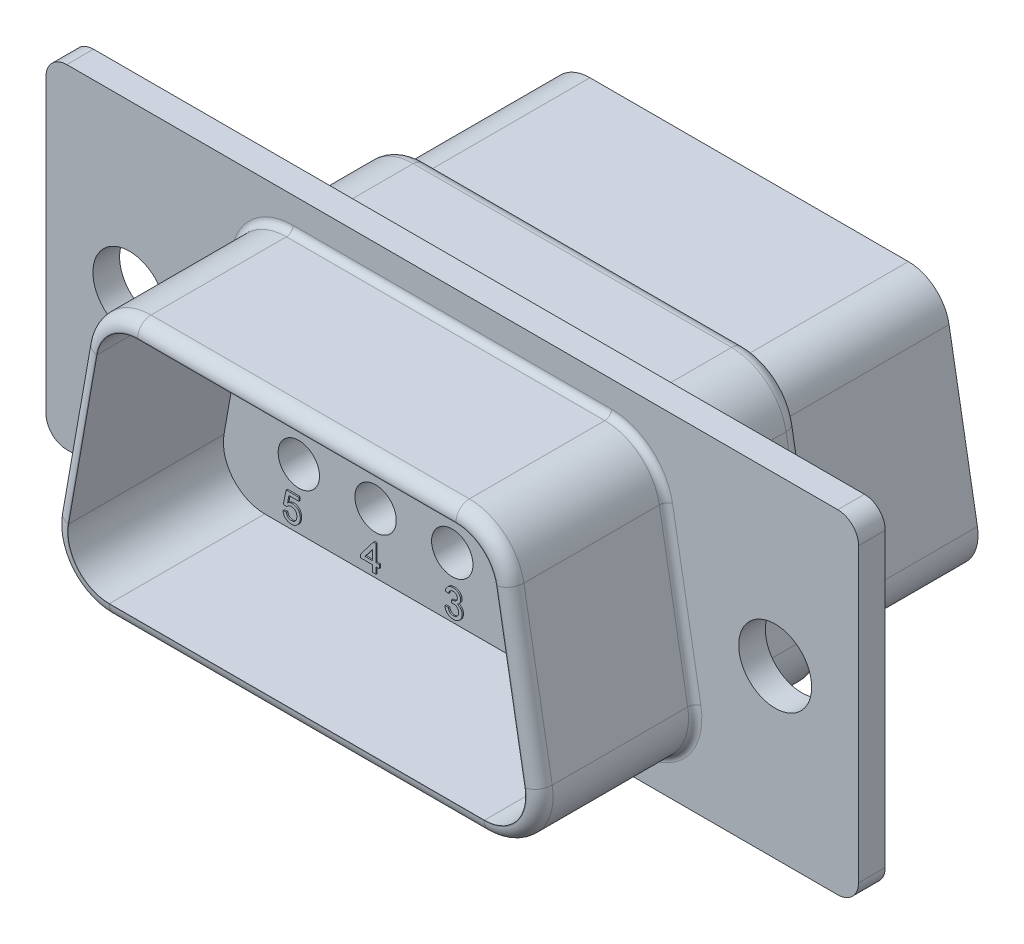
SolidWorks part; units mm, degrees
ref_plane "Front Plane" through (0, 0, 0) normal (0, 0, 1) x (1, 0, 0)
ref_plane "Top Plane" through (0, 0, 0) normal (0, 1, 0) x (1, 0, 0)
ref_plane "Right Plane" through (0, 0, 0) normal (1, 0, 0) x (0, 0, -1)
sketch "Sketch1" plane through (0, 0, 0) normal (0, 0, 1) x (1, 0, 0)
  line L0 (0, 0) -> (0, 12.7)
  dimension "D1" = 12.7
extrude "Extrude-Thin2" add sketch "Sketch1" along normal mid plane 1.016 thin
fillet "Fillet1" radius 0.7925 4 edges at (-15.4686, 0, 0) (-15.4686, 12.7, 0) (15.4686, 0, 0) (15.4686, 12.7, 0)
hole_wizard "7/64 (0.10938) Diameter Hole1" positions "Sketch5" profile "Sketch4" hole size "7/64" standard "Ansi Inch"
sketch "Sketch5" plane through (0, 0, 0.508) normal (0, 0, 1) x (1, 0, 0)
  line L0 (-15.4686, 0.7925) -> (-15.4686, 11.9075) construction
  line L1 (14.6761, 0) -> (-14.6761, 0) construction
  line L2 (15.4686, 0.7925) -> (15.4686, 11.9075) construction
  point P0 (12.2936, 6.35)
  point P1 (-12.2936, 6.35)
  dimension "D1" = 3.175
  dimension "D2" = 6.35
  dimension "D3" = 3.175
  dimension "D4" = 6.35
sketch "Sketch4" plane through (12.2936, 6.35, 0.508) normal (1, 0, 0) x (0, -1, 0)
  line L0 (0, 0) -> (0, 1.016)
  line L1 (0, 1.016) -> (1.3891, 1.016)
  line L2 (1.3891, 1.016) -> (1.3891, 0)
  line L5 (1.3891, 0) -> (0, 0)
  line L11 (0, -6.35) -> (0, 107.95) construction
  dimension "Thru Hole Dia." = 2.7783
  dimension "Thru Hole Depth" = 1.016
sketch "Sketch8" plane through (0, 0, 0.508) normal (0, 0, 1) x (1, 0, 0)
  line L0 (0, 12.7415) -> (0, 0) construction
  line L1 (-7.1402, 1.651) -> (7.1402, 1.651)
  line L2 (8.6911, 3.4993) -> (7.6117, 9.6207)
  line L3 (6.0609, 10.922) -> (-6.0609, 10.922)
  line L4 (-7.6117, 9.6207) -> (-8.6911, 3.4993)
  line L5 (14.6761, 0) -> (-14.6761, 0) construction
  arc A0 (8.6911, 3.4993) -> (7.1402, 1.651) centre (7.1402, 3.2258) cw
  arc A1 (6.0609, 10.922) -> (7.6117, 9.6207) centre (6.0609, 9.3472) cw
  arc A2 (-7.6117, 9.6207) -> (-6.0609, 10.922) centre (-6.0609, 9.3472) cw
  arc A3 (-7.1402, 1.651) -> (-8.6911, 3.4993) centre (-7.1402, 3.2258) cw
  point P11 (9.017, 1.651)
  point P18 (-9.017, 1.651)
  dimension "D7" = 1.5748
  dimension "D8" = 1.5748
  dimension "D9" = 1.5748
  dimension "D10" = 1.5748
  dimension "D1" = 18.034
  dimension "D2" = 80
  dimension "D3" = 80
  dimension "D4" = 9.271
  dimension "D5" = 9.017
  dimension "D6" = 1.651
extrude "Extrude-Thin3" add sketch "Sketch8" along normal blind 5.9182 and the other way blind 5.08 thin
sketch "Sketch9" plane through (0, 0, -0.508) normal (0, 0, -1) x (-1, 0, 0)
  line L0 (-8.6911, 3.4993) -> (-7.6117, 9.6207) construction
  line L1 (-7.1402, 1.651) -> (7.1402, 1.651) construction
  line L2 (8.6911, 3.4993) -> (7.6117, 9.6207) construction
  line L3 (6.0609, 10.922) -> (-6.0609, 10.922) construction
  line L4 (-8.6911, 3.4993) -> (-7.6117, 9.6207)
  line L5 (-7.1402, 1.651) -> (7.1402, 1.651)
  line L6 (8.6911, 3.4993) -> (7.6117, 9.6207)
  line L7 (6.0609, 10.922) -> (-6.0609, 10.922)
  arc A0 (-6.0609, 10.922) -> (-7.6117, 9.6207) centre (-6.0609, 9.3472) ccw construction
  arc A1 (-8.6911, 3.4993) -> (-7.1402, 1.651) centre (-7.1402, 3.2258) ccw construction
  arc A2 (7.1402, 1.651) -> (8.6911, 3.4993) centre (7.1402, 3.2258) ccw construction
  arc A3 (7.6117, 9.6207) -> (6.0609, 10.922) centre (6.0609, 9.3472) ccw construction
  arc A4 (-6.0609, 10.922) -> (-7.6117, 9.6207) centre (-6.0609, 9.3472) ccw
  arc A5 (-8.6911, 3.4993) -> (-7.1402, 1.651) centre (-7.1402, 3.2258) ccw
  arc A6 (7.1402, 1.651) -> (8.6911, 3.4993) centre (7.1402, 3.2258) ccw
  arc A7 (7.6117, 9.6207) -> (6.0609, 10.922) centre (6.0609, 9.3472) ccw
extrude "Extrude2" add sketch "Sketch9" along normal blind 10.287
fillet "Fillet2" radius 0.508 8 edges at (7.416, 10.9622, -4.572) (8.6767, 6.6526, -4.572) (8.7552, 1.8707, -4.572) (0, 1.1176, -4.572) (-8.7552, 1.8707, -4.572) (-8.6767, 6.6526, -4.572) (-7.416, 10.9622, -4.572) (0, 11.4554, -4.572)
fillet "Fillet3" radius 0.254 8 edges at (-7.416, 10.9622, -0.508) (-8.6767, 6.6526, -0.508) (-8.7552, 1.8707, -0.508) (0, 1.1176, -0.508) (8.7552, 1.8707, -0.508) (8.6767, 6.6526, -0.508) (7.416, 10.9622, -0.508) (0, 11.4554, -0.508)
fillet "Fillet4" radius 0.254 8 edges at (-7.416, 10.9622, 0.508) (-8.6767, 6.6526, 0.508) (-8.7552, 1.8707, 0.508) (0, 1.1176, 0.508) (8.7552, 1.8707, 0.508) (8.6767, 6.6526, 0.508) (7.416, 10.9622, 0.508) (0, 11.4554, 0.508)
fillet "Fillet5" radius 0.508 8 edges at (7.416, 10.9622, 6.4262) (8.6767, 6.6526, 6.4262) (8.7552, 1.8707, 6.4262) (0, 1.1176, 6.4262) (-8.7552, 1.8707, 6.4262) (-8.6767, 6.6526, 6.4262) (-7.416, 10.9622, 6.4262) (0, 11.4554, 6.4262)
hole_wizard "Hole1" positions "Sketch14" profile "Sketch13" legacy
sketch "Sketch14" plane through (0, 0, -10.795) normal (0, 0, -1) x (-1, 0, 0)
  line L0 (-11.1236, 3.937) -> (12.066, 3.937) construction
  line L2 (-7.1402, 1.651) -> (7.1402, 1.651) construction
  line L3 (-10.1813, 8.636) -> (11.1236, 8.636) construction
  line L5 (6.0609, 10.922) -> (-6.0609, 10.922) construction
  line L6 (0, 0) -> (0, 15.8223) construction
  line L8 (2.921, 0) -> (2.921, 15.8223) construction
  line L9 (-2.921, 0) -> (-2.921, 15.8223) construction
  line L10 (5.842, 0) -> (5.842, 15.8223) construction
  line L11 (-5.842, 0) -> (-5.842, 15.8223) construction
  point P0 (0, 3.937)
  point P28 (5.842, 3.937)
  point P30 (2.921, 3.937)
  point P32 (-2.921, 3.937)
  point P35 (-5.842, 3.937)
  point P37 (-4.4494, 8.636)
  point P39 (-1.4737, 8.636)
  point P41 (1.4209, 8.636)
  point P43 (4.3426, 8.636)
  dimension "D1" = 2.286
  dimension "D2" = 2.286
  dimension "D5" = 2.286
  dimension "D6" = 2.921
  dimension "D3" = 2.921
  dimension "D4" = 2.921
sketch "Sketch13" plane through (0, 3.937, -10.795) normal (1, 0, 0) x (0, 1, 0)
  line L0 (0, 0) -> (0, 11.303)
  line L1 (0, 11.303) -> (0.7874, 11.303)
  line L2 (0.7874, 11.303) -> (0.7874, 8.255)
  line L3 (0.7874, 8.255) -> (1.0541, 8.255)
  line L4 (1.0541, 8.255) -> (1.0541, 0)
  line L5 (1.0541, 0) -> (0, 0)
  line L6 (0, 110) -> (0, -10) construction
  dimension "Diameter" = 1.5748
  dimension "Depth" = 11.303
  dimension "C-Bore Diameter" = 2.1082
  dimension "C-Bore Depth" = 8.255
sketch "Sketch15" plane through (0, 0, 0.508) normal (0, 0, 1) x (1, 0, 0)
  text T0 "1" font "Arial" height in points 4
extrude "Extrude3" add sketch "Sketch15" along normal blind 0.0508
sketch "Sketch18" plane through (0, 0, 0.508) normal (0, 0, 1) x (1, 0, 0)
  text T0 "2" font "Arial" height in points 4
extrude "Extrude4" add sketch "Sketch18" along normal blind 0.0508
sketch "Sketch20" plane through (0, 0, 0.508) normal (0, 0, 1) x (1, 0, 0)
  text T0 "3"
extrude "Extrude5" add sketch "Sketch20" along normal blind 0.0508
sketch "Sketch21" plane through (0, 0, 0.508) normal (0, 0, 1) x (1, 0, 0)
  text T0 "4"
extrude "Extrude6" add sketch "Sketch21" along normal blind 0.0508
sketch "Sketch22" plane through (0, 0, 0.508) normal (0, 0, 1) x (1, 0, 0)
  text T0 "5"
extrude "Extrude7" add sketch "Sketch22" along normal blind 0.0508
sketch "Sketch23" plane through (0, 0, 0.508) normal (0, 0, 1) x (1, 0, 0)
  text T0 "6"
extrude "Extrude8" add sketch "Sketch23" along normal blind 0.0508
sketch "Sketch24" plane through (0, 0, 0.508) normal (0, 0, 1) x (1, 0, 0)
  text T0 "7"
extrude "Extrude9" add sketch "Sketch24" along normal blind 0.0508
sketch "Sketch26" plane through (0, 0, 0.508) normal (0, 0, 1) x (1, 0, 0)
  text T0 "9"
extrude "Extrude11" add sketch "Sketch26" along normal blind 0.0508
sketch "Sketch25" plane through (0, 0, 0.508) normal (0, 0, 1) x (1, 0, 0)
  text T0 "8"
extrude "Extrude10" add sketch "Sketch25" along normal blind 0.0508
sketch "Sketch27" plane through (0, 0, -10.795) normal (0, 0, -1) x (-1, 0, 0)
  text T0 "1"
extrude "Extrude12" add sketch "Sketch27" along normal blind 0.0508
sketch "Sketch28" plane through (0, 0, -10.795) normal (0, 0, -1) x (-1, 0, 0)
  text T0 "2"
extrude "Extrude13" add sketch "Sketch28" along normal blind 0.0508
sketch "Sketch29" plane through (0, 0, -10.795) normal (0, 0, -1) x (-1, 0, 0)
  text T0 "3"
extrude "Extrude14" add sketch "Sketch29" along normal blind 0.0508
sketch "Sketch30" plane through (0, 0, -10.795) normal (0, 0, -1) x (-1, 0, 0)
  text T0 "4"
extrude "Extrude15" add sketch "Sketch30" along normal blind 0.0508
sketch "Sketch31" plane through (0, 0, -10.795) normal (0, 0, -1) x (-1, 0, 0)
  text T0 "5"
extrude "Extrude16" add sketch "Sketch31" along normal blind 0.0508
sketch "Sketch32" plane through (0, 0, -10.795) normal (0, 0, -1) x (-1, 0, 0)
  text T0 "6"
extrude "Extrude17" add sketch "Sketch32" along normal blind 0.0508
sketch "Sketch33" plane through (0, 0, -10.795) normal (0, 0, -1) x (-1, 0, 0)
  text T0 "7"
extrude "Extrude18" add sketch "Sketch33" along normal blind 0.0508
sketch "Sketch34" plane through (0, 0, -10.795) normal (0, 0, -1) x (-1, 0, 0)
  text T0 "8"
extrude "Extrude19" add sketch "Sketch34" along normal blind 0.0508
sketch "Sketch35" plane through (0, 0, -10.795) normal (0, 0, -1) x (-1, 0, 0)
  text T0 "9"
extrude "Extrude20" add sketch "Sketch35" along normal blind 0.0508
